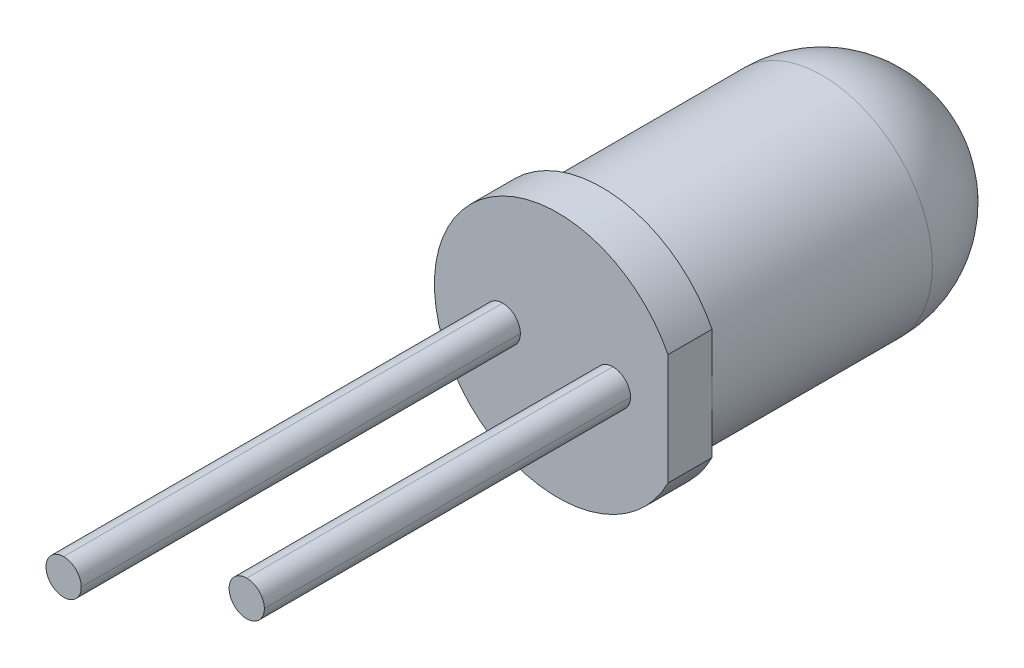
SolidWorks part; units mm, degrees
ref_plane "Face" through (0, 0, 0) normal (0, 0, 1) x (1, 0, 0)
ref_plane "Dessus" through (0, 0, 0) normal (0, 1, 0) x (1, 0, 0)
ref_plane "Droite" through (0, 0, 0) normal (1, 0, 0) x (0, 0, -1)
sketch "Esquisse1" plane through (0, 0, 0) normal (0, 0, 1) x (1, 0, 0)
  circle A0 centre (0, 0) radius 2.5
extrude "Base-Extrusion" add sketch "Esquisse1" along normal blind 8.5
sketch "Esquisse2" plane through (0, 0, 8.5) normal (0, 0, 1) x (1, 0, 0)
  line L0 (2.5, -2.4917) -> (2.5, 2.5621) construction
  line L1 (2.5, 1.261) -> (2.5, -1.261)
  arc A0 (2.5, 1.261) -> (2.5, -1.261) centre (0, 0) ccw
extrude "Boss.-Extru.1" add sketch "Esquisse2" against normal blind 1
fillet "Congé1" radius 2.5 1 edges at (2.5, 0, 0)
sketch "Esquisse3" plane through (0, 0, 0) normal (0, 1, 0) x (1, 0, 0)
  line L0 (1.25, -7.973) -> (1.25, -20.8794) construction
  line L1 (-1.25, -8.48) -> (-1.25, -20.1183) construction
  line L2 (-1.65, -8.48) -> (-0.85, -8.48)
  line L4 (0.85, -8.48) -> (0.85, -16.8089)
  line L5 (1.65, -8.48) -> (1.65, -16.8089)
  line L6 (-1.65, -8.48) -> (-1.65, -18.4636)
  line L7 (-0.85, -8.48) -> (-0.85, -18.4636)
  line L8 (0.85, -8.48) -> (1.65, -8.48)
  line L9 (1.65, -16.8089) -> (0.85, -16.8089)
  line L10 (-0.85, -18.4636) -> (-1.65, -18.4636)
extrude "Boss.-Extru.2" add sketch "Esquisse3" along normal mid plane 0.8
fillet "Congé2" radius 0.4 24 edges at (1.25, -0.4, 8.5) (1.65, 0, 8.5) (0.85, 0, 8.5) (1.25, 0.4, 8.5) (0.85, -0.4, 12.6545) (1.25, -0.4, 16.8089) (0.85, 0, 16.8089) (1.65, 0, 16.8089) (1.65, -0.4, 12.6545) (0.85, 0.4, 12.6545) (1.25, 0.4, 16.8089) (1.65, 0.4, 12.6545) (-1.25, -0.4, 8.5) (-0.85, 0, 8.5) (-1.65, 0, 8.5) (-1.25, 0.4, 8.5) (-1.65, -0.4, 13.4818) (-1.25, -0.4, 18.4636) (-1.65, 0, 18.4636) (-0.85, 0, 18.4636) (-0.85, -0.4, 13.4818) (-1.65, 0.4, 13.4818) (-1.25, 0.4, 18.4636) (-0.85, 0.4, 13.4818)
